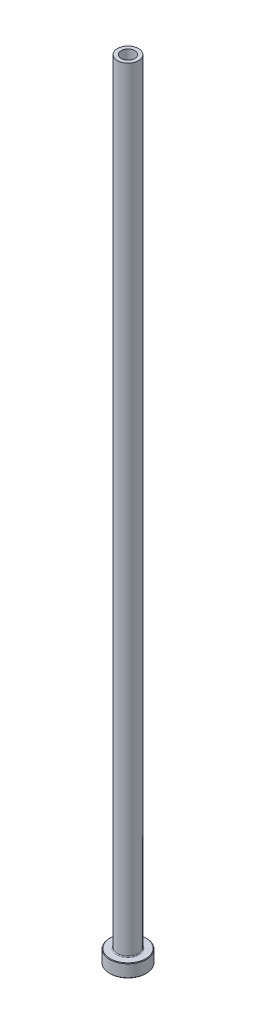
SolidWorks part; units mm, degrees
ref_plane "Front Plane" through (0, 0, 0) normal (0, 0, 1) x (1, 0, 0)
ref_plane "Top Plane" through (0, 0, 0) normal (0, 1, 0) x (1, 0, 0)
ref_plane "Right Plane" through (0, 0, 0) normal (1, 0, 0) x (0, 0, -1)
sketch "Sketch1" plane through (0, 0, 0) normal (0, 0, 1) x (1, 0, 0)
  line L0 (-2.6, 300) -> (-4, 300)
  line L1 (-4, 300) -> (-4, 5)
  line L2 (-4, 5) -> (-7, 5)
  line L3 (-7, 5) -> (-7, 0)
  line L4 (7.7, 0) -> (-7.7, 0) construction
  line L5 (-7, 0) -> (-2.85, 0)
  line L6 (-2.6, 255) -> (-2.6, 300)
  line L7 (0, 92.1877) -> (0, -15.5353) construction
  line L8 (0, -7.7) -> (0, 7.7) construction
  line L9 (-2.6, 255) -> (-2.85, 243)
  line L10 (-2.85, 243) -> (-2.85, 0)
  dimension "D1" = 0.25
  dimension "ID" = 5.2
  dimension "OD" = 8
  dimension "L" = 300
  dimension "H" = 14
  dimension "T" = 5
  dimension "N" = 45
  dimension "D2" = 12
revolve "Revolve1" add sketch "Sketch1" angle 360 about L7
fillet "Fillet1" radius 0.3 1 edges at (0, 5, 4)
chamfer "Chamfer1" distance 0.2 angle 45 2 edges at (0, 5, 7) (0, 0, 7)
chamfer "Chamfer3" distance 0.5 angle 45 1 edges at (0, 0, 2.85)
